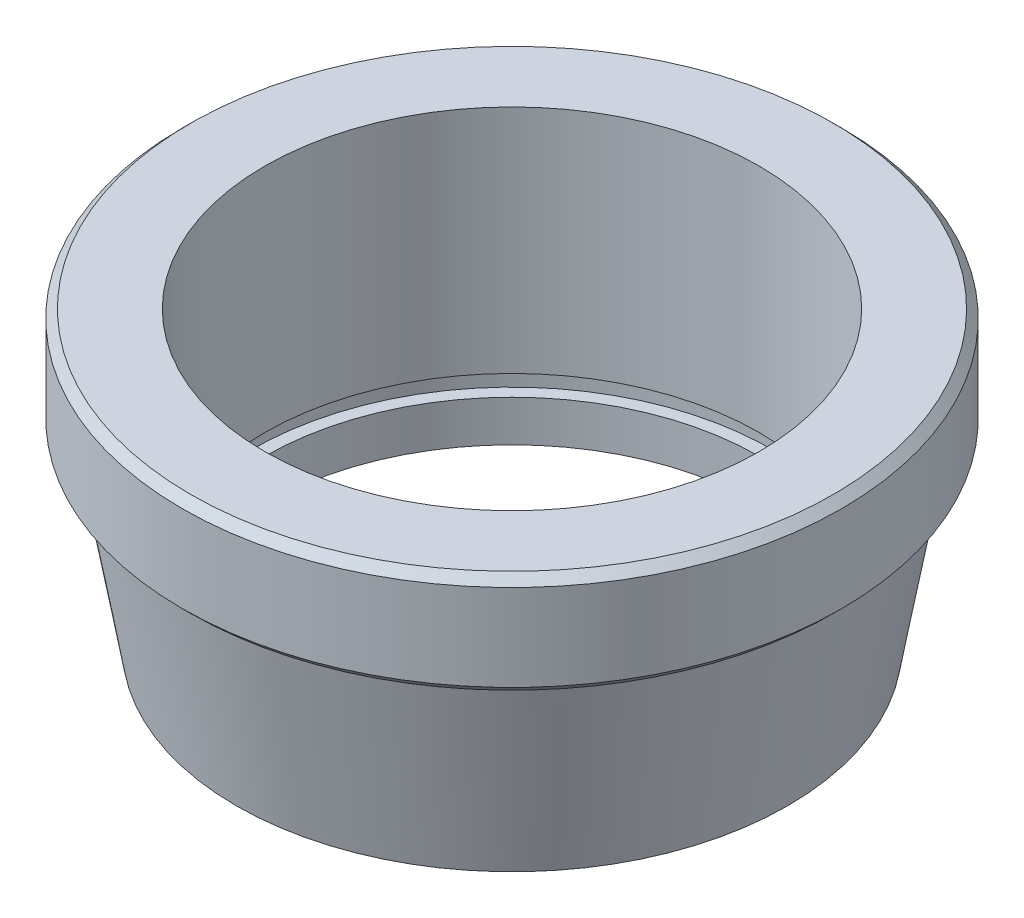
SolidWorks part; units mm, degrees
ref_plane "Přední rovina" through (0, 0, 0) normal (0, 0, 1) x (1, 0, 0)
ref_plane "Horní rovina" through (0, 0, 0) normal (0, 1, 0) x (1, 0, 0)
ref_plane "Pravá rovina" through (0, 0, 0) normal (1, 0, 0) x (0, 0, -1)
sketch "Skica1" plane through (0, 0, 0) normal (0, 1, 0) x (1, 0, 0)
  circle A0 centre (0, 0) radius 7.5
extrude "Přidat vysunutím1" add sketch "Skica1" against normal blind 4.6 draft 10
sketch "Skica2" plane through (0, 0, 0) normal (0, 1, 0) x (-1, 0, 0)
  circle A0 centre (0, 0) radius 8
extrude "Přidat vysunutím2" add sketch "Skica2" along normal blind 2.5
chamfer "Zkosení1" distance 0.2 angle 45 2 edges at (0, 0, 8) (0, 2.5, 8)
sketch "Skica3" plane through (0, 2.5, 0) normal (0, 1, 0) x (1, 0, 0)
  circle A0 centre (0, 0) radius 6
extrude "Odebrat vysunutím1" cut sketch "Skica3" against normal blind 2.5
sketch "Skica4" plane through (0, -4.6, 0) normal (0, -1, 0) x (1, 0, 0)
  circle A0 centre (0, 0) radius 6
extrude "Odebrat vysunutím2" cut sketch "Skica4" against normal up to surface (4.6 mm away)
sketch "Skica5" plane through (0, 0, 0) normal (0, 0, 1) x (1, 0, 0)
  line L0 (-6.6889, -4.6) -> (6.6889, -4.6) construction
  line L1 (-6.3, -3.6) -> (-6, -3.6)
  line L2 (-6.3, -3.6) -> (-6.3, -3.1)
  line L3 (-6.3, -3.1) -> (-6, -3.1)
  line L4 (-6, -3.6) -> (-6, -3.1)
  line L5 (-6, -4.6) -> (6, -4.6) construction
  point P8 (-3.25, -4.6)
  dimension "D1" = 0.3
  dimension "D2" = 0.5
  dimension "D3" = 1
  dimension "D5" = 6.3
ref_axis "Osa1" through (0, 2.5, 0) along (0, -1, 0)
revolve "Odebrat rotací1" cut sketch "Skica5" angle 360 about axis through (0, 2.5, 0) along (0, -1, 0)
